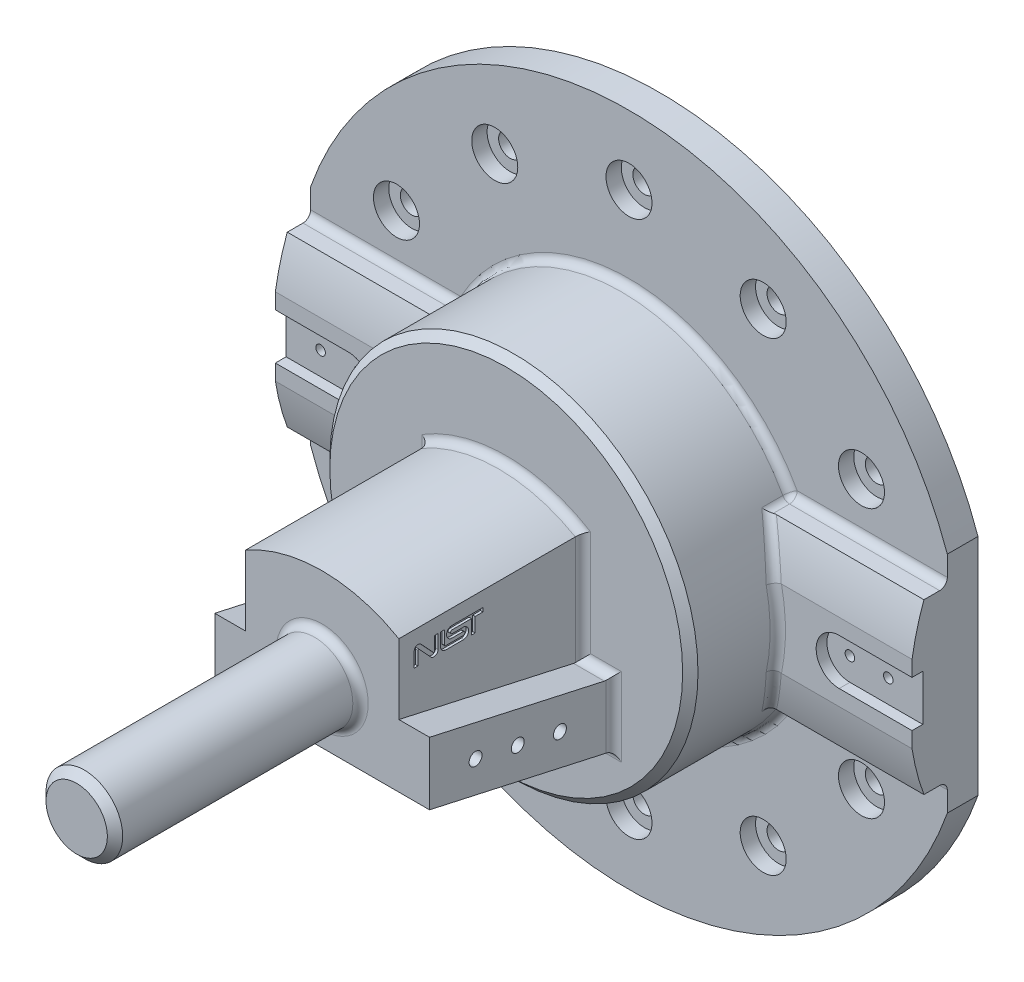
SolidWorks part; units mm, degrees
other "DetailItem8"
other "DetailItem9"
ref_plane "Front Plane" through (0, 0, 0) normal (0, 0, 1) x (1, 0, 0)
ref_plane "Top Plane" through (0, 0, 0) normal (0, 1, 0) x (1, 0, 0)
ref_plane "Right Plane" through (0, 0, 0) normal (1, 0, 0) x (0, 0, -1)
sketch "Sketch1" plane through (0, 0, 0) normal (0, 0, 1) x (1, 0, 0)
  line L0 (-263.525, 92.8382) -> (-263.525, -92.8382)
  line L1 (263.525, 92.8382) -> (263.525, -92.8382)
  arc A0 (263.525, 92.8382) -> (-263.525, 92.8382) centre (0, 0) ccw
  arc A1 (-263.525, -92.8382) -> (263.525, -92.8382) centre (0, 0) ccw
  dimension "D1" = 263.525
  dimension "D2" = 279.4
  dimension "D4" = 279.4
  dimension "D3" = 527.05
extrude "Boss-Extrude1" add sketch "Sketch1" along normal blind 25.4
sketch "Sketch2" plane through (0, 0, 25.4) normal (0, 0, 1) x (1, 0, 0)
  circle A0 centre (0, 0) radius 152.4
  dimension "D1" = 304.8
extrude "Boss-Extrude2" add sketch "Sketch2" along normal blind 101.6
sketch "Sketch3" plane through (263.525, 0, 0) normal (1, 0, 0) x (0, 0, -1)
  line L0 (-44.7672, 69.85) -> (-25.4, 69.85)
  line L1 (-25.4, -92.8382) -> (-25.4, 92.8382) construction
  line L2 (-25.4, -69.85) -> (-44.7672, -69.85)
  line L3 (-25.4, -69.85) -> (-25.4, 69.85)
  line L4 (-54.61, -40.64) -> (-54.61, 40.64) construction
  line L5 (-54.61, -32.0282) -> (-54.61, 32.0282)
  line L6 (-158.7344, 69.85) -> (-25.4, 69.85) construction
  line L7 (-54.61, -40.64) -> (-158.7344, -40.64) construction
  line L8 (-158.7344, 40.64) -> (-54.61, 40.64) construction
  line L9 (-25.4, -69.85) -> (-158.7344, -69.85) construction
  arc A0 (-44.7672, 69.85) -> (-54.61, 32.0282) centre (146.05, 0) ccw
  arc A1 (-54.61, -32.0282) -> (-44.7672, -69.85) centre (146.05, 0) ccw
  point P0 (146.05, 0)
  dimension "D4" = 203.2
  dimension "D5" = 203.2
  dimension "D1" = 69.85
  dimension "D2" = 139.7
  dimension "D3" = 29.21
extrude "Boss-Extrude3" add sketch "Sketch3" against normal up to surface (527.05 mm away)
sketch "Sketch4" plane through (0, 0, 54.61) normal (0, 0, 1) x (1, 0, 0)
  line L0 (-280, 19.05) -> (-203.2, 19.05)
  line L1 (-280, -19.05) -> (-203.2, -19.05)
  line L2 (-280, 19.05) -> (-280, -19.05)
  line L4 (203.2, -19.05) -> (280, -19.05)
  line L5 (203.2, 19.05) -> (280, 19.05)
  line L6 (280, 19.05) -> (280, -19.05)
  arc A0 (-203.2, 19.05) -> (-203.2, -19.05) centre (-203.2, 0) cw
  arc A1 (203.2, -19.05) -> (203.2, 19.05) centre (203.2, 0) cw
  dimension "D3" = 280
  dimension "D7" = 19.05
  dimension "D8" = 19.05
  dimension "D1" = 203.2
  dimension "D2" = 406.4
  dimension "D4" = 280
  dimension "D5" = 38.1
  dimension "D6" = 19.05
extrude "Cut-Extrude1" cut sketch "Sketch4" against normal blind 8.89
hole_wizard "3/8-16 Tapped Hole1" positions "Sketch6" profile "Sketch5" tap size "3/8-16" standard "ANSI Inch"
sketch "Sketch6" plane through (0, 0, 45.72) normal (0, 0, 1) x (1, 0, 0)
  point P0 (-234.95, 0)
  point P2 (-203.2, 0)
  point P4 (203.2, 0)
  point P6 (234.95, 0)
  dimension "D1" = 203.2
  dimension "D2" = 31.75
  dimension "D3" = 203.2
  dimension "D4" = 31.75
  dimension "D5" = 0
sketch "Sketch5" plane through (-234.95, 0, 45.72) normal (1, 0, 0) x (0, -1, 0)
  line L0 (0, 0) -> (0, 32.8647)
  line L1 (0, 32.8647) -> (3.9687, 30.48)
  line L2 (3.9687, 30.48) -> (3.9687, 0)
  line L5 (3.9687, 0) -> (0, 0)
  line L10 (0, 32.8647) -> (-3.9688, 30.48) construction
  line L11 (0, -6.35) -> (0, 107.95) construction
  dimension "Tap Drill Dia." = 7.9375
  dimension "Tap Drill Depth" = 30.48
  dimension "Drill Angle" = 118
hole_wizard "CBORE for #00 Binding Head Machine Screw1" positions "Sketch8" profile "Sketch7" counterbore size "#00" standard "ANSI Inch"
sketch "Sketch8" plane through (0, 0, 25.4) normal (0, 0, 1) x (1, 0, 0)
  point P0 (-192.4741, -111.125)
  point P2 (-111.1128, -192.4812)
  point P4 (0, -222.25)
  point P6 (111.1128, -192.4812)
  point P8 (192.4741, -111.125)
  point P10 (192.4741, 111.125)
  point P12 (111.1128, 192.4812)
  point P14 (0, 222.25)
  point P16 (-111.1128, 192.4812)
  point P18 (-192.4741, 111.125)
  dimension "D1" = 222.25
  dimension "D2" = 222.25
  dimension "D3" = 192.4812
  dimension "D4" = 192.4812
  dimension "D5" = 111.125
  dimension "D6" = 111.125
  dimension "D7" = 222.25
  dimension "D8" = 222.25
  dimension "D9" = 222.25
  dimension "D10" = 222.25
sketch "Sketch7" plane through (-192.4741, -111.125, 25.4) normal (1, 0, 0) x (0, -1, 0)
  line L0 (0, 0) -> (0, 25.4)
  line L1 (0, 25.4) -> (9.525, 25.4)
  line L3 (9.525, 25.4) -> (9.525, 12.7)
  line L4 (9.525, 12.7) -> (19.05, 12.7)
  line L5 (19.05, 12.7) -> (19.05, 0)
  line L7 (19.05, 0) -> (0, 0)
  line L11 (0, -6.35) -> (0, 107.95) construction
  dimension "Thru Hole Dia." = 19.05
  dimension "Thru Hole Depth" = 25.4
  dimension "C'Bore Dia." = 38.1
  dimension "C'Bore Depth" = 12.7
sketch "Sketch9" plane through (0, 0, 0) normal (0, 0, -1) x (-1, 0, 0)
  circle A0 centre (0, 0) radius 127
  dimension "D1" = 254
extrude "Cut-Extrude2" cut sketch "Sketch9" against normal blind 101.6
sketch "Sketch10" plane through (0, 0, 127) normal (0, 0, 1) x (1, 0, 0)
  line L2 (-88.9, 39.8961) -> (-88.9, -84.582)
  line L3 (-88.9, -84.582) -> (88.9, -84.582)
  line L4 (88.9, 39.8961) -> (88.9, -84.582)
  arc A0 (88.9, 39.8961) -> (-88.9, 39.8961) centre (0, -50.8) ccw
  point P4 (0, -50.8)
  dimension "D5" = 127
  dimension "D1" = 177.8
  dimension "D2" = 88.9
  dimension "D3" = 84.582
  dimension "D4" = 50.8
extrude "Boss-Extrude4" add sketch "Sketch10" along normal blind 152.4
sketch "Sketch11" plane through (0, 0, 279.4) normal (0, 0, 1) x (1, 0, 0)
  circle A0 centre (0, 0) radius 31.75
  dimension "D1" = 63.5
extrude "Boss-Extrude5" add sketch "Sketch11" along normal blind 203.2
draft "Draft2" type of draft neutral plane draft angle 12.5 faces to draft 1 parameters "D1"=12.5
sketch "Sketch12" plane through (88.9, 0, 0) normal (1, 0, 0) x (0, 0, -1)
  line L0 (-313.3048, 8.7542) -> (-127, -32.5486)
  line L1 (-127, -84.582) -> (-127, 39.8961) construction
  line L2 (-127, -32.5486) -> (-127, 135.3345)
  line L3 (-313.3048, 135.3345) -> (-127, 135.3345)
  line L4 (-313.3048, 8.7542) -> (-313.3048, 135.3345)
  line L5 (-279.4, -50.7957) -> (-127, -84.582) construction
  dimension "D1" = 50.8
extrude "Cut-Extrude3" cut sketch "Sketch12" against normal blind 25.4
hole_wizard "1/2-13 Tapped Hole1" positions "Sketch14" profile "Sketch13" tap size "1/2-13" standard "ANSI Inch"
sketch "Sketch14" plane through (88.9, 0, 0) normal (1, 0, 0) x (0, 0, -1)
  line L0 (-127, 152.4) -> (-127, -152.4) construction
  line L1 (-279.4, -50.7957) -> (-127, -84.582) construction
  point P0 (-171.45, -48.711)
  point P2 (-206.375, -40.9683)
  point P4 (-241.3, -33.2256)
  dimension "D1" = 44.45
  dimension "D2" = 25.4
  dimension "D3" = 79.375
  dimension "D4" = 25.4
  dimension "D5" = 114.3
  dimension "D6" = 25.4
sketch "Sketch13" plane through (88.9, -48.711, 171.45) normal (0, 1, 0) x (0, 0, -1)
  line L0 (0, 0) -> (0, 33.6995)
  line L1 (0, 33.6995) -> (5.3581, 30.48)
  line L2 (5.3581, 30.48) -> (5.3581, 0)
  line L5 (5.3581, 0) -> (0, 0)
  line L10 (0, 33.6995) -> (-5.3581, 30.48) construction
  line L11 (0, -6.35) -> (0, 107.95) construction
  dimension "Tap Drill Dia." = 10.7163
  dimension "Tap Drill Depth" = 30.48
  dimension "Drill Angle" = 118
mirror "Mirror1" about plane through (0, 0, 0) normal (1, 0, 0) of "1/2-13 Tapped Hole1", "Cut-Extrude3"
chamfer "Chamfer1" distance 6.35 angle 45 2 edges at (152.4, 0, 127) (31.75, 0, 482.6)
chamfer "Chamfer2" distance 9.525 angle 45 1 edges at (-127, 0, 0)
fillet "Fillet1" radius 6.35 25 edges at (-76.2, -32.5486, 127) (-88.9, -58.5653, 127) (-63.5, 13.3183, 127) (0, 76.2, 127) (63.5, 13.3183, 127) (76.2, -32.5486, 127) (88.9, -58.5653, 127) (0, -84.582, 127) (-199.4876, 69.85, 25.4) (135.4501, 69.85, 35.0836) (-135.4501, 69.85, 35.0836) (152.4, 0, 54.61) (-152.4, 0, 54.61) (135.4501, -69.85, 35.0836) (-135.4501, -69.85, 35.0836) (-199.4876, -69.85, 25.4) (0, -152.4, 25.4) (199.4876, -69.85, 25.4) (0, 152.4, 25.4) (199.4876, 69.85, 25.4) (31.75, 0, 279.4)
ref_point "Point1"
ref_plane "Plane5" through (0, 76.2, 0) normal (0, 1, 0) x (1, 0, 0)
sketch "Sketch17" plane through (0, 76.2, 0) normal (0, 1, 0) x (1, 0, 0)
  line L0 (0, -266.7) -> (0, -228.6)
  line L1 (-289.8775, 0) -> (289.8775, 0) construction
  dimension "D1" = 228.6
  dimension "D2" = 266.7
sketch "Sketch18" plane through (63.5, 0, 0) normal (1, 0, 0) x (0, 0, -1)
  line L0 (-244.9189, 46.75) -> (-244.9189, 35.9457)
  line L1 (-240.7232, 31.75) -> (-225.5227, 31.75)
  line L2 (-225.5227, 40.7729) -> (-235.1494, 40.7729)
  line L3 (-235.0345, 43.589) -> (-219.3444, 43.589)
  line L4 (-219.3444, 43.589) -> (-219.3444, 31.75)
  line L5 (-219.3444, 31.75) -> (-216.2419, 31.75)
  line L6 (-216.2419, 31.75) -> (-216.2419, 43.589)
  line L7 (-216.2419, 43.589) -> (-209.8326, 43.589)
  line L8 (-209.8326, 43.589) -> (-209.8326, 46.75)
  line L9 (-209.8326, 46.75) -> (-235.4359, 46.75)
  line L10 (-235.0919, 37.6696) -> (-226.0401, 37.6696)
  line L11 (-225.9826, 34.8532) -> (-240.6941, 34.8532)
  line L12 (-241.7866, 35.9457) -> (-241.7866, 46.75)
  line L13 (-241.7866, 46.75) -> (-244.9189, 46.75)
  line L14 (-266.7, 31.75) -> (-266.7, 43.9121)
  line L15 (-261.0448, 46.1261) -> (-250.78, 35.0257)
  line L16 (-250.0623, 35.3419) -> (-250.0623, 46.75)
  line L17 (-250.0623, 46.75) -> (-246.9301, 46.75)
  line L18 (-246.9301, 46.75) -> (-246.9301, 35.2671)
  line L19 (-253.1932, 33.0694) -> (-262.6603, 43.359)
  line L20 (-263.5975, 42.9935) -> (-263.5975, 31.75)
  line L21 (-263.5975, 31.75) -> (-266.7, 31.75)
  arc A0 (-244.9189, 35.9457) -> (-240.7232, 31.75) centre (-240.7232, 35.9457) ccw
  arc A1 (-225.5227, 31.75) -> (-225.5227, 40.7729) centre (-226.2411, 36.2615) ccw
  arc A2 (-235.0345, 43.589) -> (-235.1494, 40.7729) centre (-235.1494, 42.1833) ccw
  arc A3 (-235.4359, 46.75) -> (-235.0919, 37.6696) centre (-235.4359, 42.2033) ccw
  arc A4 (-225.9826, 34.8532) -> (-226.0401, 37.6696) centre (-226.1628, 36.2583) ccw
  arc A5 (-261.0448, 46.1261) -> (-266.7, 43.9121) centre (-263.439, 43.9121) ccw
  arc A6 (-250.78, 35.0257) -> (-250.0623, 35.3419) centre (-250.4755, 35.3072) ccw
  arc A7 (-262.6603, 43.359) -> (-263.5975, 42.9935) centre (-263.0576, 42.9935) ccw
  arc A8 (-241.7866, 35.9457) -> (-240.6941, 34.8532) centre (-240.6941, 35.9457) ccw
  arc A9 (-253.1932, 33.0694) -> (-246.9301, 35.2671) centre (-250.4472, 35.2671) ccw
extrude "Cut-Extrude4" cut sketch "Sketch18" against normal blind 2.032
